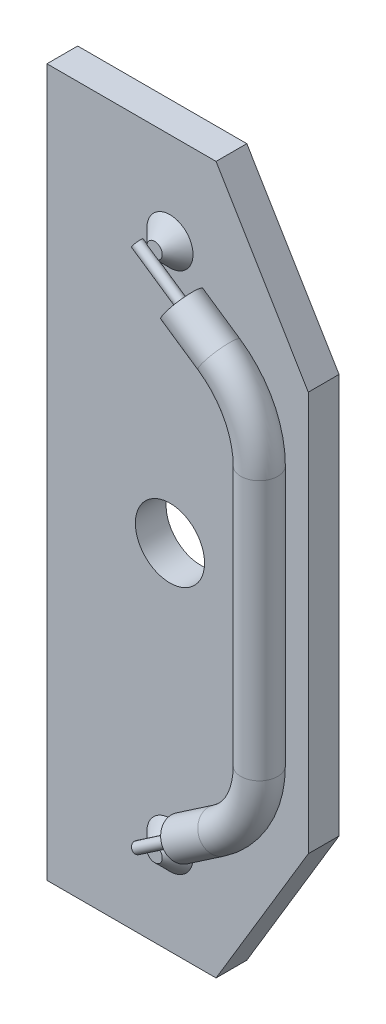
SolidWorks part; units mm, degrees
ref_plane "Plan1" through (0, 0, 0) normal (0, 0, 1) x (1, 0, 0)
ref_plane "Plan2" through (0, 0, 0) normal (0, 1, 0) x (1, 0, 0)
ref_plane "Plan3" through (0, 0, 0) normal (1, 0, 0) x (0, 0, -1)
sketch "Esquisse1" plane through (0, 0, 0) normal (0, 0, 1) x (1, 0, 0)
  line L0 (3, 23) -> (9, 13)
  line L1 (-8, 23) -> (3, 23)
  line L2 (-8, 23) -> (-8, 0)
  line L3 (2.25, 0) -> (9, 0)
  line L4 (9, 13) -> (9, 0)
  line L6 (-8, 0) -> (-2.25, 0)
  arc A0 (2.25, 0) -> (-2.25, 0) centre (0, 0) ccw
  dimension "D1" = 4.5
  dimension "D2" = 23
  dimension "D3" = 8
  dimension "D4" = 9
  dimension "D5" = 10
  dimension "D6" = 11
extrude "Base-Extrusion" add sketch "Esquisse1" along normal blind 2
sketch "Esquisse2" plane through (0, 0, 2) normal (0, 0, 1) x (1, 0, 0)
  circle A0 centre (0, 17) radius 1.5
  dimension "D2" = 3
  dimension "D1" = 17
extrude "soudure sup" add sketch "Esquisse2" along normal blind 1 draft 45
sketch "Esquisse3" plane through (0, 0, 0) normal (0, 0, -1) x (-1, 0, 0)
  circle A0 centre (0, 17) radius 2
  dimension "D1" = 4
  dimension "D2" = 17
extrude "soudure inf" add sketch "Esquisse3" along normal blind 3
chamfer "Chanfrein1" distance 1.5 angle 45
sketch "Esquisse4" plane through (0, 0, 0) normal (0, 1, 0) x (1, 0, 0)
  circle A0 centre (7, -3.19) radius 1.2
  dimension "D1" = 2.4
  dimension "D2" = 7
ref_plane "Plan4" through (0, 0, 3.19) normal (0, 0, 1) x (1, 0, 0)
sketch "Esquisse5" plane through (0, 0, 3.19) normal (0, 0, 1) x (1, 0, 0)
  line L0 (7, 0) -> (7, 8.4537)
  line L1 (4.3781, 13.4124) -> (1.9624, 15.0581)
  arc A0 (7, 8.4537) -> (4.3781, 13.4124) centre (1, 8.4537) ccw
  circle A1 centre (0, 17) radius 0.5 construction
  dimension "D1" = 6
sweep "cable" add profiles "Esquisse4" path "Esquisse5"
sketch "Esquisse7" plane through (-5.6662, 3.8601, 0) normal (-0.8264, 0.563, 0) x (0, 0, 1)
  circle A0 centre (3.19, 13.5496) radius 0.3317
  arc A1 (2, 13.395) -> (2, 13.7042) centre (3.19, 13.5496) ccw construction
extrude "fil" add sketch "Esquisse7" along normal blind 3.5
mirror "Symétrie1"
